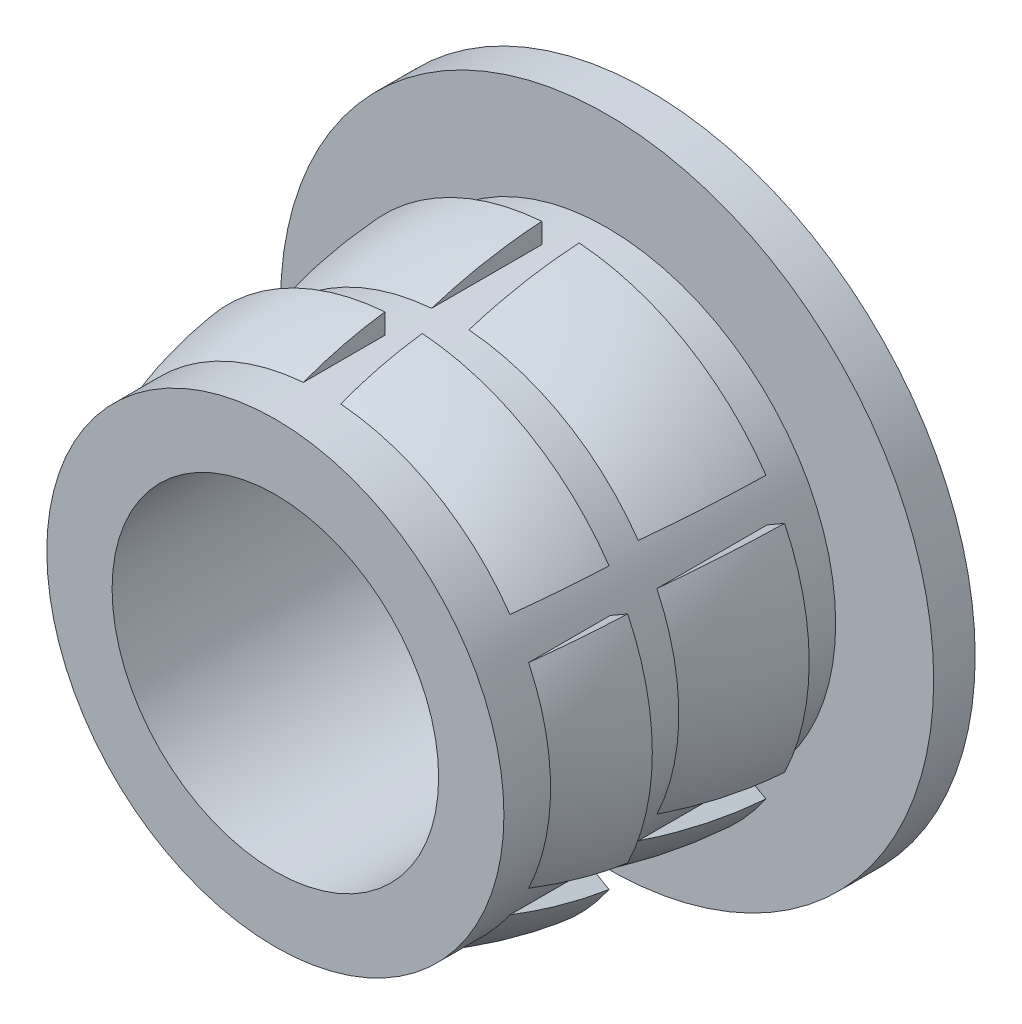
SolidWorks part; units mm, degrees
other "<flanged insert M8 S1>-<M8x1.0 Tapped Hole1>"
ref_plane "Front Plane" through (0, 0, 0) normal (0, 0, 1) x (1, 0, 0)
ref_plane "Top Plane" through (0, 0, 0) normal (0, 1, 0) x (1, 0, 0)
ref_plane "Right Plane" through (0, 0, 0) normal (1, 0, 0) x (0, 0, -1)
inserted part "flanged insert M8 S1"
move or copy body "Body-Move/Copy4"
